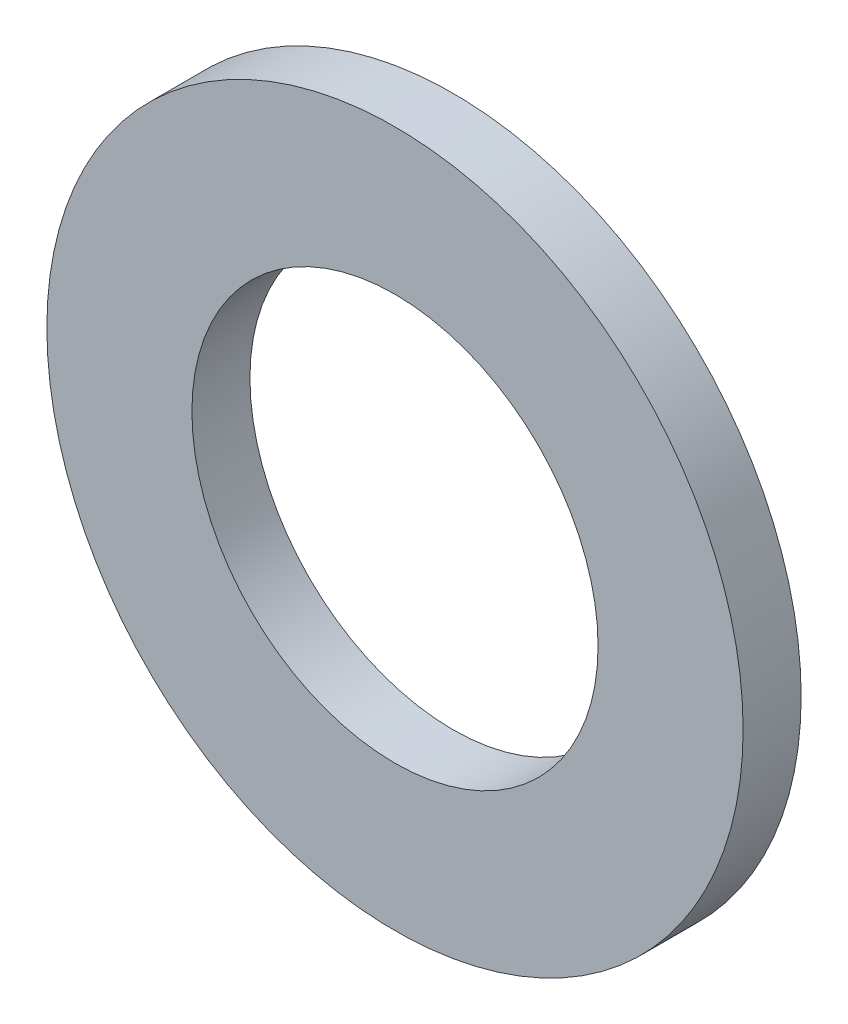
SolidWorks part; units mm, degrees
ref_plane "Plan de face" through (0, 0, 0) normal (0, 0, 1) x (1, 0, 0)
ref_plane "Plan de dessus" through (0, 0, 0) normal (0, 1, 0) x (1, 0, 0)
ref_plane "Plan de droite" through (0, 0, 0) normal (1, 0, 0) x (0, 0, -1)
sketch "Esquisse1" plane through (0, 0, 0) normal (0, 0, 1) x (1, 0, 0)
  circle A0 centre (0, 0) radius 10.5
  circle A1 centre (0, 0) radius 18
  dimension "D1" = 21
  dimension "D2" = 36
extrude "Extrusion1" add sketch "Esquisse1" along normal blind 3
